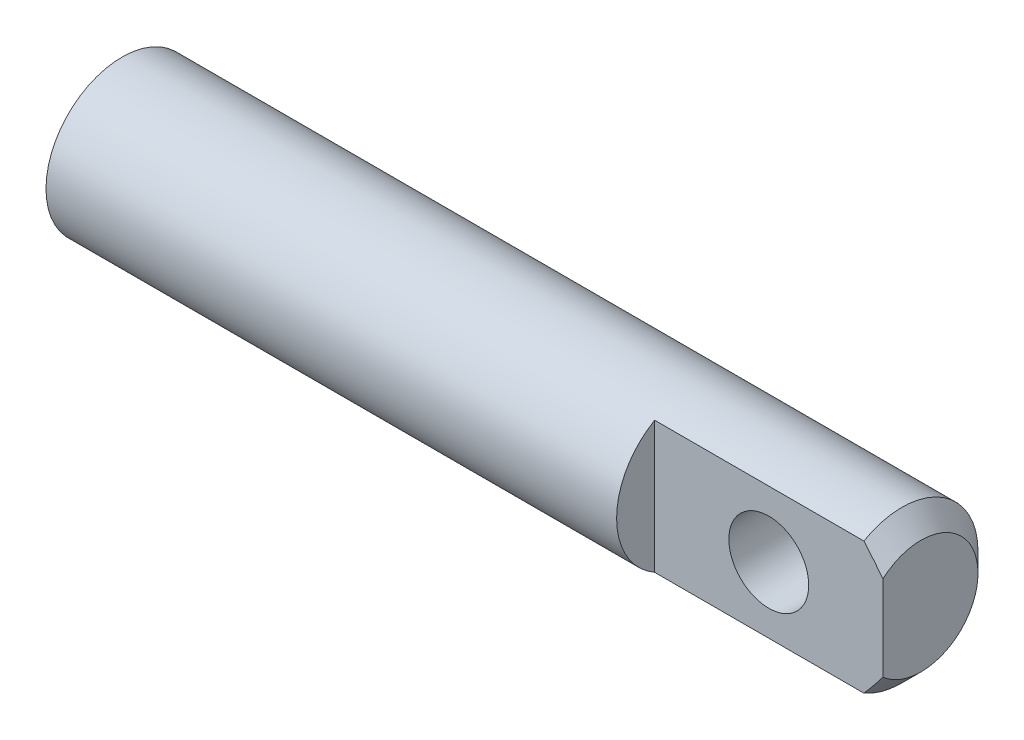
SolidWorks part; units mm, degrees
ref_plane "Front Plane" through (0, 0, 0) normal (0, 0, 1) x (1, 0, 0)
ref_plane "Top Plane" through (0, 0, 0) normal (0, 1, 0) x (1, 0, 0)
ref_plane "Right Plane" through (0, 0, 0) normal (1, 0, 0) x (0, 0, -1)
sketch "Sketch1" plane through (0, 0, 0) normal (0, 0, 1) x (1, 0, 0)
  line L0 (0, 0) -> (21, 0) construction
  line L1 (0, 0) -> (0, 2)
  line L2 (0, 2) -> (20.5, 2)
  line L3 (21, 1.5) -> (21, 0)
  line L4 (0, 0) -> (21, 0)
  line L6 (20.5, 2) -> (21, 1.5)
  point P3 (0, 2)
  point P5 (21, 2)
  dimension "A" = 21
  dimension "D2" = 4
revolve "Revolve1" add sketch "Sketch1" angle 360 about L0
sketch "Sketch4" plane through (21, 0, 0) normal (1, 0, 0) x (0, 0, -1)
  line L0 (-1, 1.7321) -> (-1, -1.7321)
  arc A0 (-1, 1.7321) -> (-1, -1.7321) centre (0, 0) ccw
  circle A1 centre (0, 0) radius 2 construction
  dimension "D1" = 3
extrude "Cut-Extrude3" cut sketch "Sketch4" against normal blind 6
sketch "Sketch5" plane through (0, 0, 1) normal (0, 0, 1) x (1, 0, 0)
  line L0 (21, 1.118) -> (21, -1.118) construction
  circle A0 centre (18, 0) radius 1.05
  dimension "D2" = 2.1
  dimension "D1" = 3
extrude "Cut-Extrude4" cut sketch "Sketch5" against normal through all
